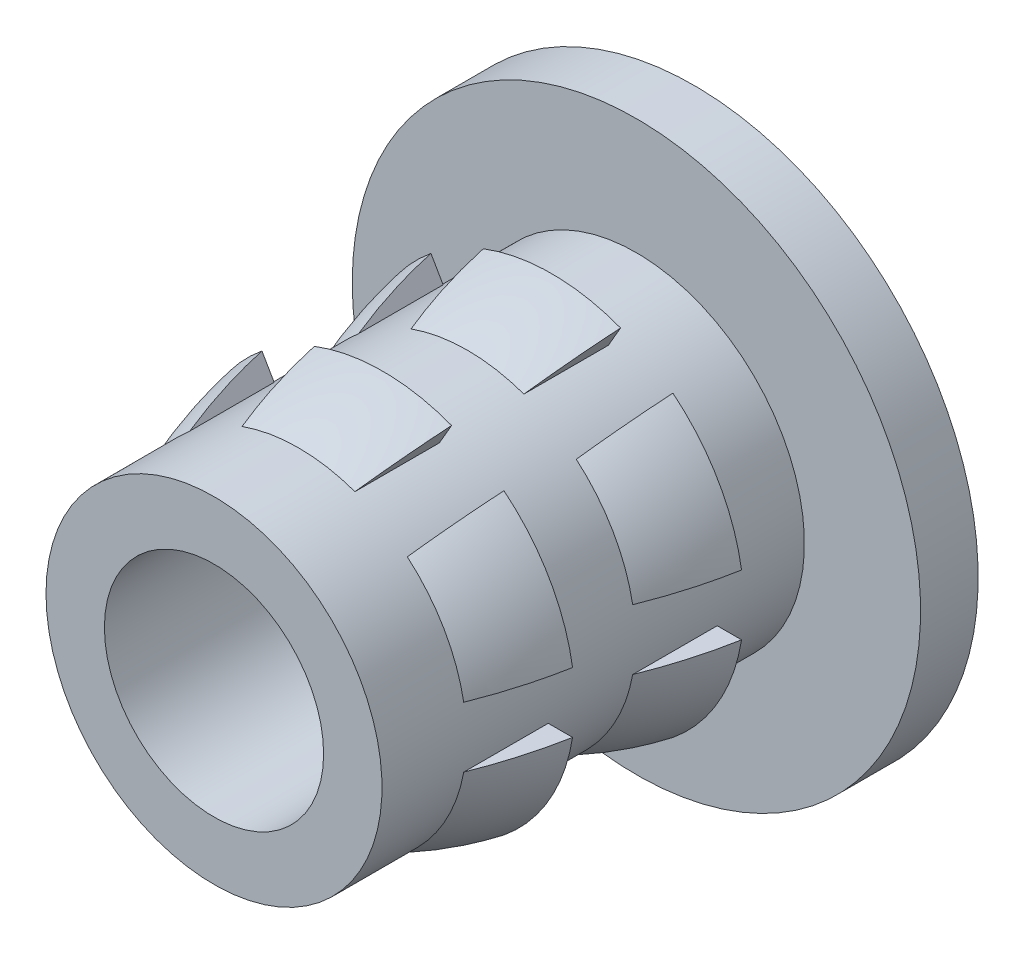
SolidWorks part; units mm, degrees
other "<flanged insert M3.5>-<CirPattern1>"
ref_plane "Front Plane" through (0, 0, 0) normal (0, 0, 1) x (1, 0, 0)
ref_plane "Top Plane" through (0, 0, 0) normal (0, 1, 0) x (1, 0, 0)
ref_plane "Right Plane" through (0, 0, 0) normal (1, 0, 0) x (0, 0, -1)
inserted part "flanged insert M3.5"
